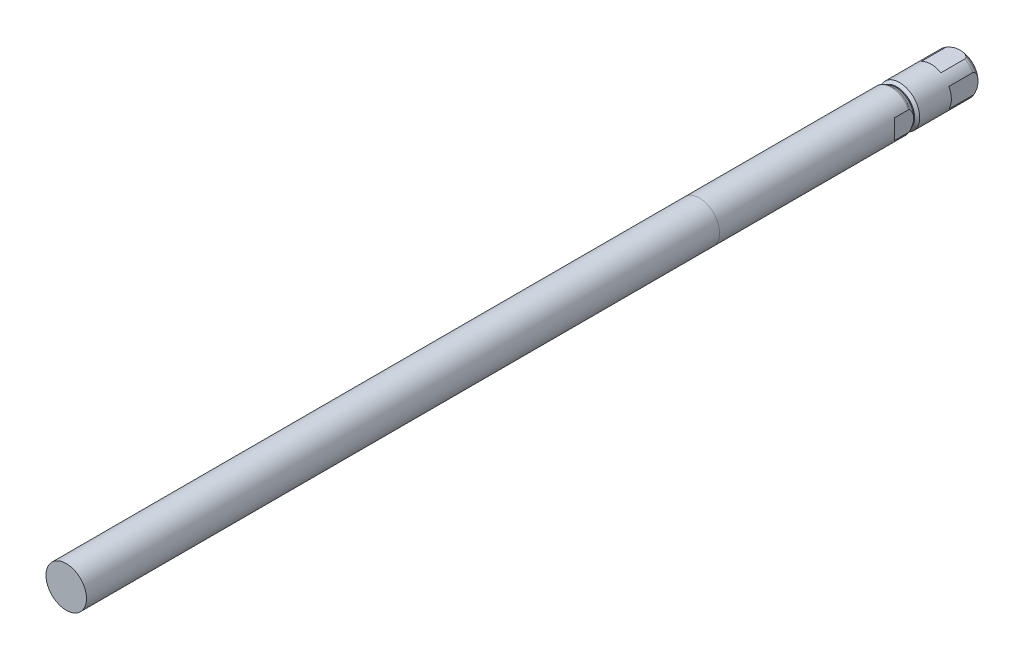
SolidWorks part; units mm, degrees
ref_plane "前视基准面" through (0, 0, 0) normal (0, 0, 1) x (1, 0, 0)
ref_plane "上视基准面" through (0, 0, 0) normal (0, 1, 0) x (1, 0, 0)
ref_plane "右视基准面" through (0, 0, 0) normal (1, 0, 0) x (0, 0, -1)
imported_body "连接头-1-surface1"
imported_body "导轴-1-surface1"
sketch "草图1" plane through (0, 0, 71.5) normal (0, 0, 1) x (1, 0, 0)
  circle A0 centre (0, 0) radius 8
extrude "凸台-拉伸1" add sketch "草图1" along normal blind 250
